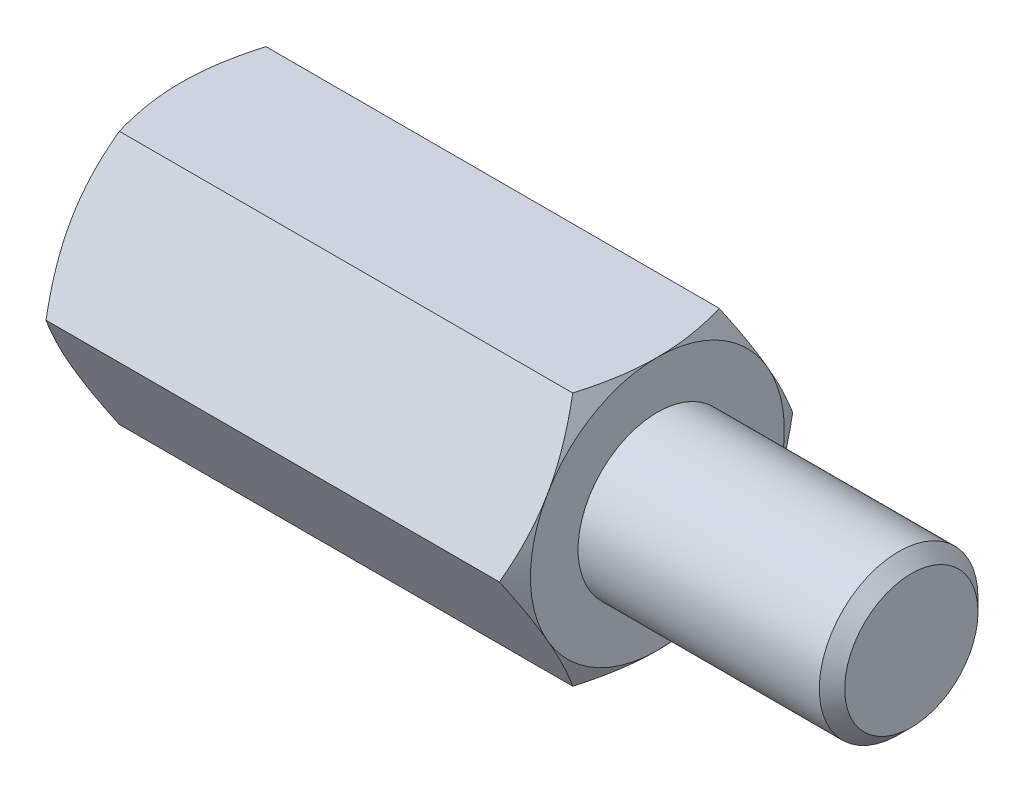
SolidWorks part; units mm, degrees
ref_plane "Front Plane" through (0, 0, 0) normal (0, 0, 1) x (1, 0, 0)
ref_plane "Top Plane" through (0, 0, 0) normal (0, 1, 0) x (1, 0, 0)
ref_plane "Right Plane" through (0, 0, 0) normal (1, 0, 0) x (0, 0, -1)
sketch "Sketch1" plane through (0, 0, 0) normal (1, 0, 0) x (0, 0, -1)
  line L1 (2.3094, 4) -> (-2.3094, 4)
  line L2 (-2.3094, 4) -> (-4.6188, 0)
  line L3 (-4.6188, 0) -> (-2.3094, -4)
  line L4 (-2.3094, -4) -> (2.3094, -4)
  line L5 (2.3094, -4) -> (4.6188, 0)
  line L6 (4.6188, 0) -> (2.3094, 4)
  circle A0 centre (0, 0) radius 4 construction
  dimension "D1" = 8
extrude "Extrude2" add sketch "Sketch1" along normal mid plane 15
sketch "Sketch2" plane through (0, 0, 0) normal (0, 0, 1) x (1, 0, 0)
  line L0 (-7.5, 4) -> (-6, 6.5981)
  line L1 (-7.5, 7) -> (-7.5, 4)
  line L3 (0, 0) -> (50000, 0) construction
  arc A0 (-6, 6.5981) -> (-7.5, 7) centre (-6.6962, 7) ccw
  dimension "D1" = 30
  dimension "D2" = 3
revolve "Cut-Revolve1" cut sketch "Sketch2" angle 360 about L3
mirror "Mirror1" about plane through (0, 0, 0) normal (1, 0, 0) of "Cut-Revolve1"
sketch "Sketch3" plane through (-7.5, 0, 0) normal (-1, 0, 0) x (0, 0, 1)
  circle A0 centre (0, 0) radius 2.1
  dimension "D1" = 4.2
extrude "Extrude3" cut sketch "Sketch3" against normal blind 8
sketch "Sketch4" plane through (0, 0, 0) normal (0, 0, 1) x (1, 0, 0)
  line L0 (0.5, 0) -> (0.5, 2.1)
  line L1 (7.1427, 0) -> (-7.1427, 0) construction
  line L2 (0.5, 2.1) -> (1.7124, 0)
  line L3 (1.7124, 0) -> (0.5, 0)
  line L4 (-7.5, 2) -> (-7.5, -2) construction
  point P4 (-7.5, 0)
  dimension "D1" = 30
  dimension "D2" = 2.1
  dimension "D3" = 8
revolve "Cut-Revolve2" cut sketch "Sketch4" angle 360 about L3
sketch "Sketch5" plane through (7.5, 0, 0) normal (1, 0, 0) x (0, 0, -1)
  circle A0 centre (0, 0) radius 2.5
  dimension "D1" = 5
extrude "Extrude4" add sketch "Sketch5" along normal blind 8
chamfer "Chamfer1" distance 0.4 angle 45 1 edges at (15.5, 0, -2.5)
equation "\"D2@Sketch4\" = \"D1@Sketch3\"/2"
